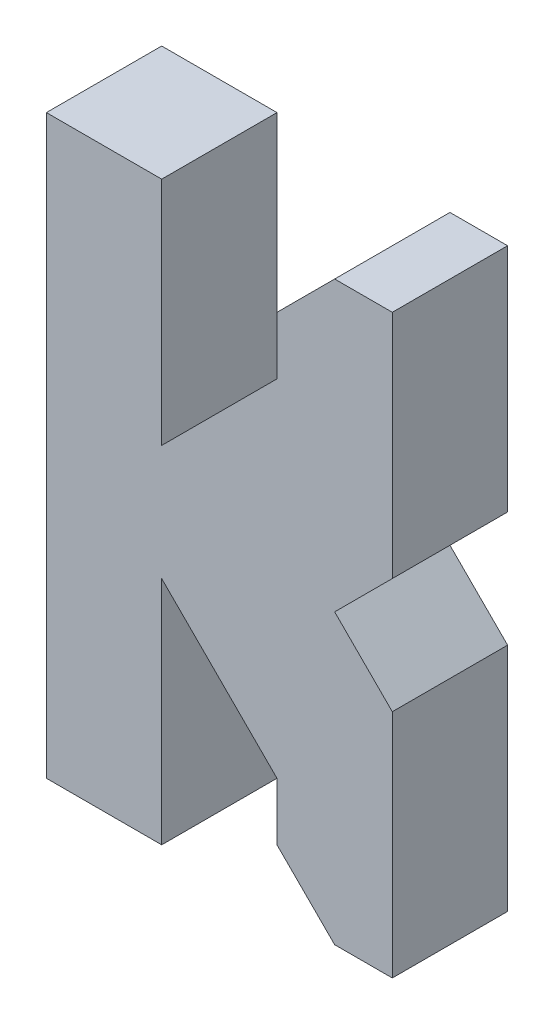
SolidWorks part; units mm, degrees
ref_plane "Plan de face" through (0, 0, 0) normal (0, 0, 1) x (1, 0, 0)
ref_plane "Plan de dessus" through (0, 0, 0) normal (0, 1, 0) x (1, 0, 0)
ref_plane "Plan de droite" through (0, 0, 0) normal (1, 0, 0) x (0, 0, -1)
sketch "Esquisse1" plane through (0, 0, 0) normal (0, 0, 1) x (1, 0, 0)
  line L0 (10, 30) -> (10, 50)
  line L1 (0, 0) -> (10, 0)
  line L2 (0, 0) -> (0, 50)
  line L3 (0, 50) -> (10, 50)
  line L4 (10, 0) -> (10, 20)
  line L5 (10, 30) -> (20, 30)
  line L7 (10, 20) -> (20, 20)
  line L9 (30, 30) -> (25, 30)
  line L10 (30, 20) -> (30, 0)
  line L11 (30, 0) -> (20, 0)
  line L12 (20, 20) -> (20, 0)
  line L14 (30, 30) -> (30, 50)
  line L15 (30, 50) -> (20, 50)
  line L16 (20, 30) -> (20, 50)
  line L17 (30, 20) -> (25, 20)
  line L18 (25, 30) -> (25, 20)
  dimension "D1" = 50
  dimension "D2" = 10
  dimension "D3" = 10
  dimension "D4" = 10
  dimension "D5" = 20
  dimension "D6" = 20
  dimension "D7" = 20
  dimension "D8" = 30
  dimension "D9" = 10
  dimension "D10" = 5
extrude "Boss.-Extru.1" add sketch "Esquisse1" along normal blind 10
chamfer "Chanfrein1" distance 5 angle 45 2 edges at (25, 30, 5) (25, 20, 5)
chamfer "Chanfrein2" distance 10 angle 45 2 edges at (20, 20, 5) (20, 30, 5)
chamfer "Chanfrein4" distance 5 angle 45 2 edges at (20, 0, 5) (20, 50, 5)
